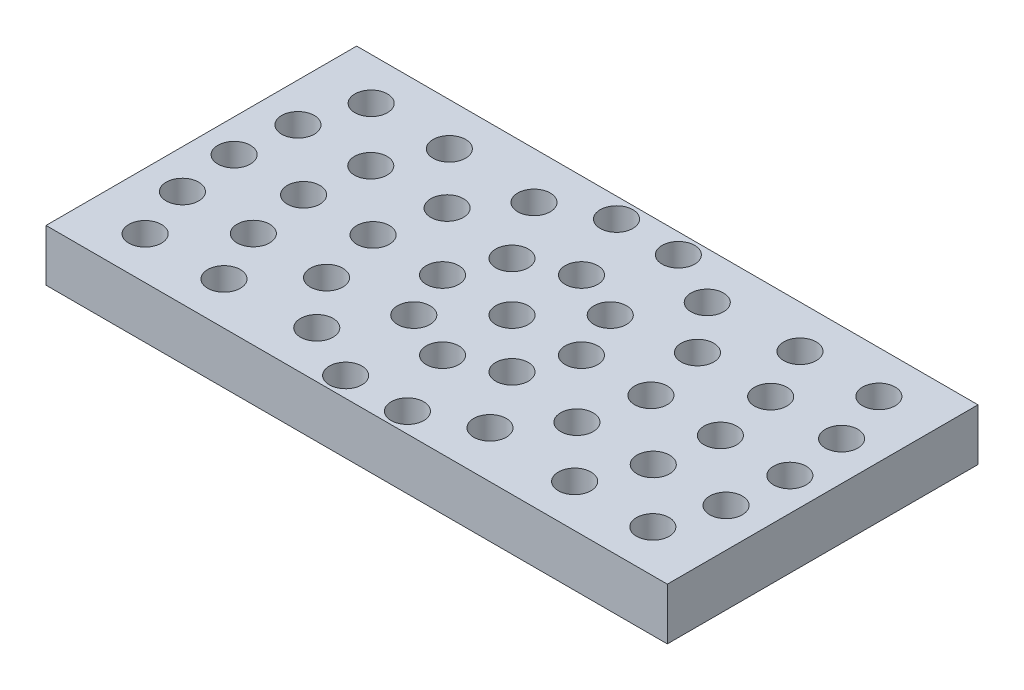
SolidWorks part; units mm, degrees
ref_plane "Front Plane" through (0, 0, 0) normal (0, 0, 1) x (1, 0, 0)
ref_plane "Top Plane" through (0, 0, 0) normal (0, 1, 0) x (1, 0, 0)
ref_plane "Right Plane" through (0, 0, 0) normal (1, 0, 0) x (0, 0, -1)
sketch "Sketch1" plane through (0, 0, 0) normal (0, 1, 0) x (1, 0, 0)
  line L1 (-76.2, 38.1) -> (76.2, 38.1)
  line L2 (-76.2, 38.1) -> (-76.2, -38.1)
  line L3 (-76.2, -38.1) -> (76.2, -38.1)
  line L4 (76.2, 38.1) -> (76.2, -38.1)
  dimension "D1" = 152.4
  dimension "D2" = 76.2
  dimension "D3" = 76.2
  dimension "D4" = 38.1
extrude "Extrude1" add sketch "Sketch1" along normal blind 12.7
other "Fill Pattern3" parameters "D10"=8, "D5"=0, "D6"=0, "D4"=17.0388, "D3"=0
